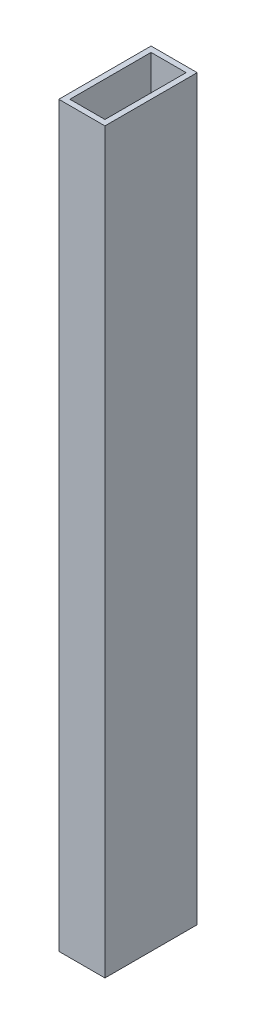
SolidWorks part; units mm, degrees
ref_plane "Front Plane" through (0, 0, 0) normal (0, 0, 1) x (1, 0, 0)
ref_plane "Top Plane" through (0, 0, 0) normal (0, 1, 0) x (1, 0, 0)
ref_plane "Right Plane" through (0, 0, 0) normal (1, 0, 0) x (0, 0, -1)
sketch "Sketch1" plane through (0, 0, 0) normal (1, 0, 0) x (0, 0, -1)
  line L1 (0, 0) -> (50, 0)
  line L2 (0, 0) -> (0, 400)
  line L3 (0, 400) -> (50, 400)
  line L4 (50, 0) -> (50, 400)
  dimension "D1" = 400
  dimension "D2" = 50
extrude "Extrude1" add sketch "Sketch1" along normal blind 25
sketch "Sketch2" plane through (0, 0, 0) normal (0, -1, 0) x (1, 0, 0)
  line L0 (0, 0) -> (0, -50) construction
  line L1 (3, -3) -> (22, -3)
  line L2 (3, -3) -> (3, -47)
  line L3 (3, -47) -> (22, -47)
  line L4 (22, -3) -> (22, -47)
  line L5 (25, 0) -> (25, -50) construction
  line L6 (25, -50) -> (0, -50) construction
  line L7 (25, 0) -> (0, 0) construction
  dimension "D1" = 3
  dimension "D2" = 3
  dimension "D3" = 3
  dimension "D4" = 3
extrude "Cut-Extrude1" cut sketch "Sketch2" against normal up to next
